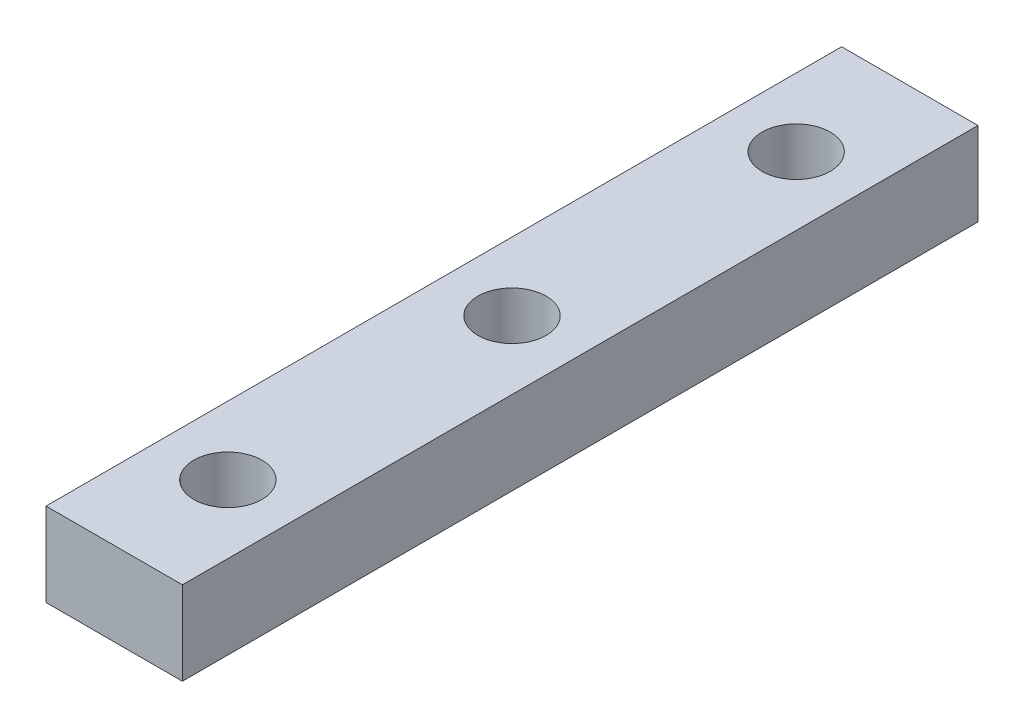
SolidWorks part; units mm, degrees
ref_plane "前视基准面" through (0, 0, 0) normal (0, 0, 1) x (1, 0, 0)
ref_plane "上视基准面" through (0, 0, 0) normal (0, 1, 0) x (1, 0, 0)
ref_plane "右视基准面" through (0, 0, 0) normal (1, 0, 0) x (0, 0, -1)
sketch "草图1" plane through (0, 0, 0) normal (0, 0, 1) x (1, 0, 0)
  line L0 (0, 0) -> (12, 0)
  line L1 (0, 0) -> (0, 7.35)
  line L2 (12, 0) -> (12, 7.35)
  line L3 (0, 7.35) -> (12, 7.35)
extrude "凸台-拉伸1" add sketch "草图1" along normal blind 70
sketch "草图2" plane through (0, 7.35, 0) normal (0, 1, 0) x (1, 0, 0)
  circle A0 centre (6, -10) radius 1.75
  circle A1 centre (6, -35) radius 1.75
  circle A2 centre (6, -60) radius 1.75
extrude "切除-拉伸1" cut sketch "草图2" against normal blind 70
sketch "草图3" plane through (0, 7.35, 0) normal (0, 1, 0) x (1, 0, 0)
  circle A0 centre (6, -10) radius 3
  circle A1 centre (6, -35) radius 3
  circle A2 centre (6, -60) radius 3
extrude "切除-拉伸2" cut sketch "草图3" against normal blind 4.5
